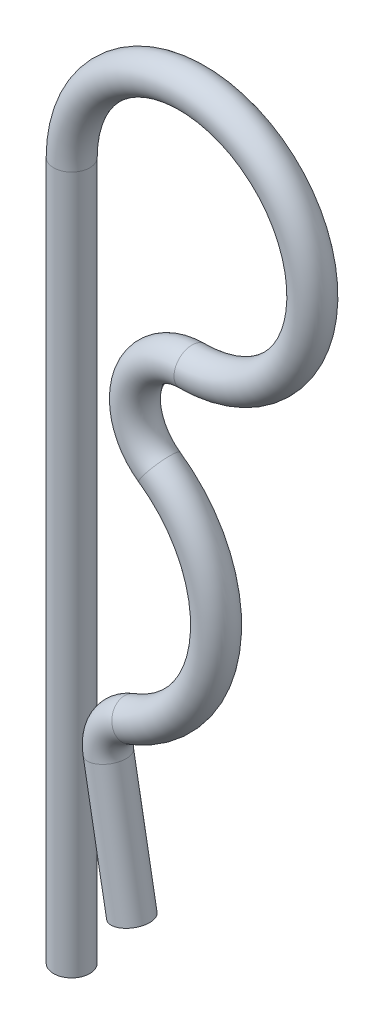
SolidWorks part; units mm, degrees
ref_plane "Plan1" through (0, 0, 0) normal (0, 0, 1) x (1, 0, 0)
ref_plane "Plan2" through (0, 0, 0) normal (0, 1, 0) x (1, 0, 0)
ref_plane "Plan3" through (0, 0, 0) normal (1, 0, 0) x (0, 0, -1)
sketch "Esquisse1" plane through (0, 0, 0) normal (0, 0, 1) x (1, 0, 0)
  line L0 (0, 0) -> (0, 58)
  line L1 (3.0476, 16.7214) -> (5, 5.896)
  arc A0 (0, 58) -> (20, 58) centre (10, 58) cw
  arc A1 (20, 58) -> (10, 48) centre (10, 58) cw
  arc A2 (10, 48) -> (7.2868, 39.357) centre (10, 43.2526) ccw
  arc A3 (7.2868, 39.357) -> (4.9286, 20.056) centre (1, 30.3306) cw
  arc A4 (4.9286, 20.056) -> (3.0476, 16.7214) centre (6, 17.2539) ccw
  dimension "D2" = 10
  dimension "D3" = 6
  dimension "D4" = 10
  dimension "D5" = 3
  dimension "D6" = 25.9988
  dimension "D7" = 1
  dimension "D10" = 4.7474
  dimension "D11" = 5
  dimension "D8" = 11
  dimension "D1" = 58
  dimension "D9" = 11
  dimension "D12" = 30.3306
sketch "Esquisse2" plane through (0, 0, 0) normal (0, 1, 0) x (1, 0, 0)
  circle A0 centre (0, 0) radius 1.5
  dimension "D1" = 3
sweep "Base-Balayage" add profiles "Esquisse2" path "Esquisse1"
